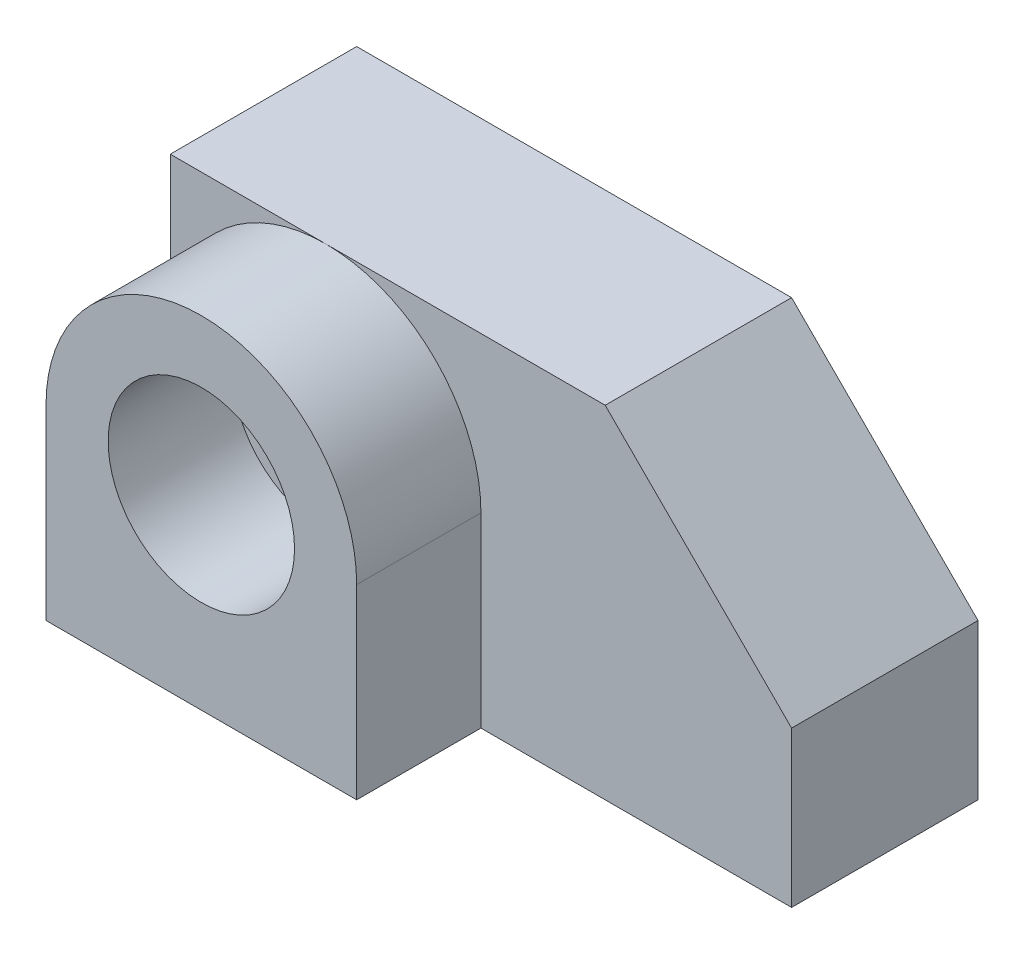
SolidWorks part; units mm, degrees
ref_plane "正面" through (0, 0, 0) normal (0, 0, 1) x (1, 0, 0)
ref_plane "平面" through (0, 0, 0) normal (0, 1, 0) x (1, 0, 0)
ref_plane "右側面" through (0, 0, 0) normal (1, 0, 0) x (0, 0, -1)
sketch "ｽｹｯﾁ1" plane through (0, 0, 0) normal (0, 0, 1) x (1, 0, 0)
  line L1 (-50, 0) -> (50, 0)
  line L2 (-50, 0) -> (-50, 55)
  line L3 (-50, 55) -> (50, 55)
  line L4 (50, 0) -> (50, 55)
  dimension "D1" = 55
  dimension "D2" = 100
extrude "押し出し1" add sketch "ｽｹｯﾁ1" against normal blind 30
chamfer "面取り1" distance 30 angle 45 1 edges at (50, 55, -15)
sketch "ｽｹｯﾁ2" plane through (0, 0, 0) normal (0, 0, 1) x (1, 0, 0)
  line L0 (-50, 0) -> (50, 0) construction
  line L1 (20, 55) -> (-50, 55) construction
  line L2 (-50, 55) -> (-50, 0) construction
  line L3 (-50, 30) -> (-50, 0)
  line L4 (-50, 0) -> (0, 0)
  line L5 (0, 0) -> (0, 30)
  circle A0 centre (-25, 30) radius 15
  arc A1 (0, 30) -> (-50, 30) centre (-25, 30) ccw
  dimension "D2" = 30
  dimension "D1" = 30
extrude "押し出し2" add sketch "ｽｹｯﾁ2" along normal blind 20
